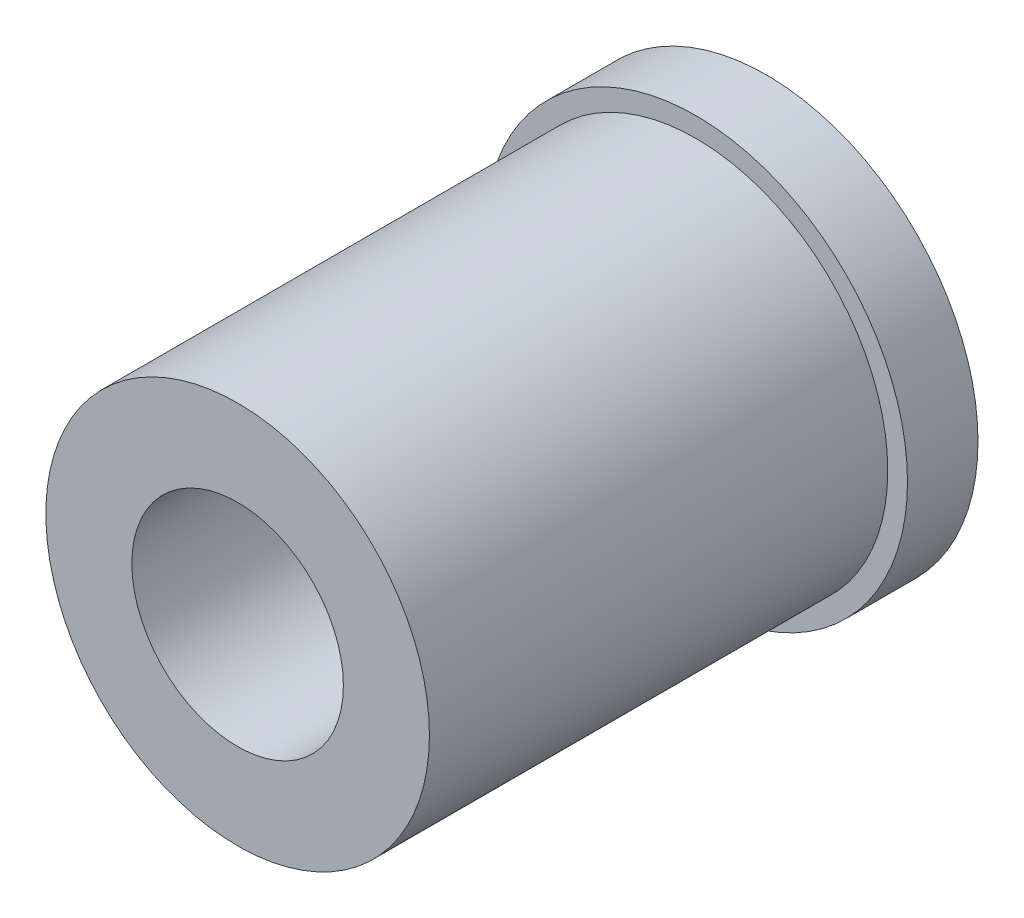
SolidWorks part; units mm, degrees
ref_plane "Front Plane" through (0, 0, 0) normal (0, 0, 1) x (1, 0, 0)
ref_plane "Top Plane" through (0, 0, 0) normal (0, 1, 0) x (1, 0, 0)
ref_plane "Right Plane" through (0, 0, 0) normal (1, 0, 0) x (0, 0, -1)
sketch "Sketch2" plane through (0, 0, 0) normal (0, 0, 1) x (1, 0, 0)
  circle A0 centre (0, 0) radius 9.525
  circle A1 centre (0, 0) radius 4.7625
  dimension "D1" = 19.05
  dimension "D2" = 9.525
extrude "Boss-Extrude1" add sketch "Sketch2" along normal blind 23.8125
sketch "Sketch3" plane through (0, 0, 23.8125) normal (0, 0, 1) x (1, 0, 0)
  circle A0 centre (0, 0) radius 9.525 construction
  circle A1 centre (0, 0) radius 9.525
  circle A2 centre (0, 0) radius 8.636
  dimension "D1" = 17.272
extrude "Cut-Extrude1" cut sketch "Sketch3" against normal blind 20.6375
